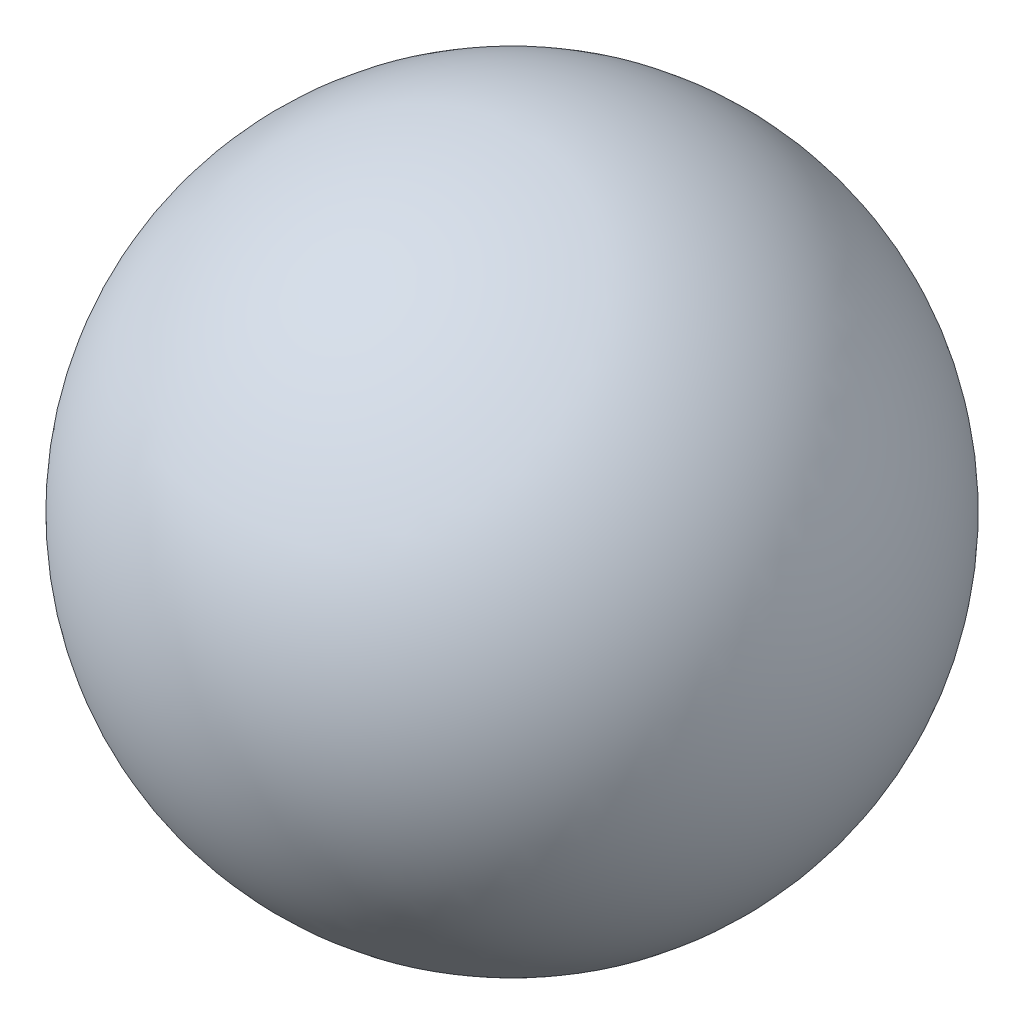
SolidWorks part; units mm, degrees
ref_plane "Plan de face" through (0, 0, 0) normal (0, 0, 1) x (1, 0, 0)
ref_plane "Plan de dessus" through (0, 0, 0) normal (0, 1, 0) x (1, 0, 0)
ref_plane "Plan de droite" through (0, 0, 0) normal (1, 0, 0) x (0, 0, -1)
sketch "Esquisse1" plane through (0, 0, 0) normal (0, 0, 1) x (1, 0, 0)
  line L0 (0, 55) -> (0, 30) construction
  line L1 (-16.75, 55) -> (16.75, 55) construction
  line L2 (-18.25, 53.5) -> (-18.25, 31.5) construction
  line L3 (-16.75, 30) -> (16.75, 30) construction
  line L4 (18.25, 53.5) -> (18.25, 31.5) construction
  line L5 (18.25, 45.65) -> (-18.25, 45.65) construction
  line L6 (18.25, 39.4) -> (-18.25, 39.4) construction
  line L7 (-18.25, 42.5) -> (18.25, 42.5) construction
  line L8 (-8.1667, 30) -> (-8.1667, 55) construction
  line L9 (0, 0) -> (18.25, 0) construction
  line L10 (-8.1667, 48.75) -> (-8.1667, 36.25)
  arc A1 (-18.25, 31.5) -> (-16.75, 30) centre (-16.75, 31.5) ccw construction
  arc A2 (-16.75, 55) -> (-18.25, 53.5) centre (-16.75, 53.5) ccw construction
  arc A3 (18.25, 53.5) -> (16.75, 55) centre (16.75, 53.5) ccw construction
  arc A4 (16.75, 30) -> (18.25, 31.5) centre (16.75, 31.5) ccw construction
  arc A6 (-8.1667, 48.75) -> (-8.1667, 36.25) centre (-8.1667, 42.5) ccw
  circle A7 centre (8.1667, 42.5) radius 6.25 construction
  dimension "D4" = 1.5
  dimension "D5" = 10.0833
  dimension "D8" = 12.5
  dimension "D1" = 30
  dimension "D2" = 55
  dimension "D3" = 36.5
  dimension "D6" = 39.4
  dimension "D7" = 45.65
revolve "Révolution1" add sketch "Esquisse1" angle 360 about L10
equation "\"D5@Esquisse1\"=(\"D3@Esquisse1\"-2*\"D8@Esquisse1\")/3+\"D8@Esquisse1\"/2"
